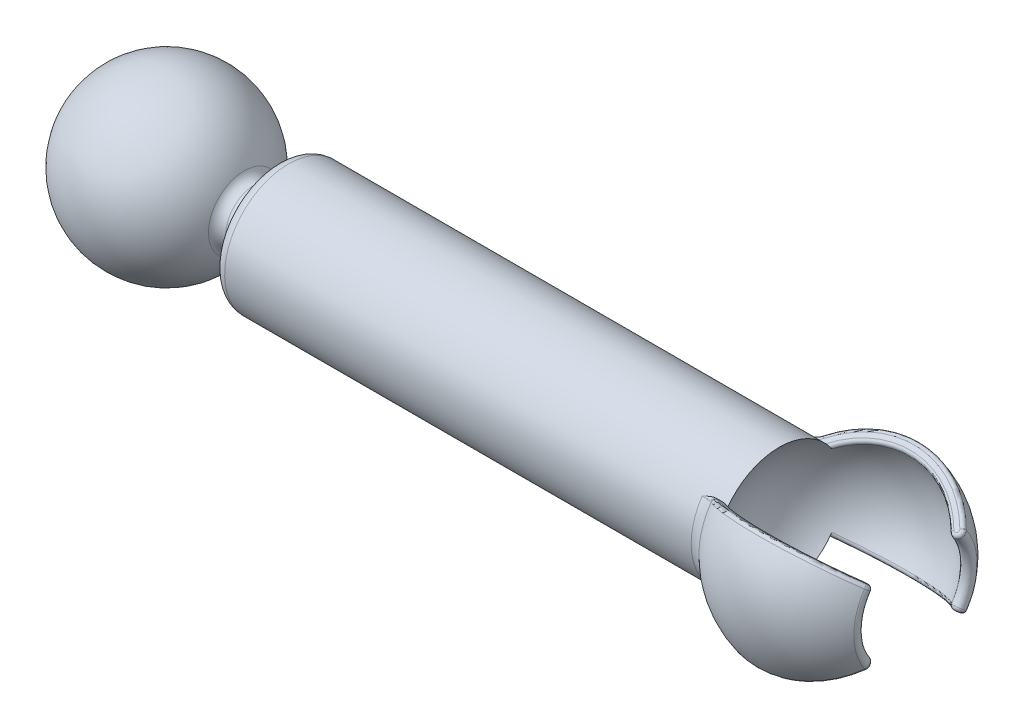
SolidWorks part; units mm, degrees
ref_plane "Front Plane" through (0, 0, 0) normal (0, 0, 1) x (1, 0, 0)
ref_plane "Top Plane" through (0, 0, 0) normal (0, 1, 0) x (1, 0, 0)
ref_plane "Right Plane" through (0, 0, 0) normal (1, 0, 0) x (0, 0, -1)
sketch "Sketch1" plane through (0, 0, 0) normal (0, 0, 1) x (1, 0, 0)
  line L0 (10.795, 3.175) -> (9.6419, 3.175)
  line L1 (12.065, 4.445) -> (12.065, 5.715)
  line L2 (13.335, 6.985) -> (67.0064, 6.985)
  line L3 (73.4822, 0) -> (-15.6104, 0) construction
  line L4 (-9.3472, 0) -> (63.9572, 0)
  arc A0 (8.4886, 3.9133) -> (-9.3472, 0) centre (0, 0) ccw
  arc A1 (67.0064, 6.985) -> (63.9572, 0) centre (73.4822, 0) ccw
  arc A2 (9.6419, 3.175) -> (8.4886, 3.9133) centre (9.6419, 4.445) cw
  arc A3 (10.795, 3.175) -> (12.065, 4.445) centre (10.795, 4.445) ccw
  arc A4 (13.335, 6.985) -> (12.065, 5.715) centre (13.335, 5.715) ccw
  dimension "D1" = 9.3472
  dimension "D2" = 9.525
  dimension "D7" = 1.27
  dimension "D3" = 63.9572
  dimension "D4" = 3.175
  dimension "D5" = 6.985
  dimension "D6" = 12.065
revolve "Revolve1" add sketch "Sketch1" angle 360 about L3
sketch "Sketch2" plane through (0, 0, 0) normal (0, 1, 0) x (1, 0, 0)
  line L0 (0, 0) -> (75.9783, 0) construction
  line L2 (13.335, -6.985) -> (67.0064, -6.985) construction
  line L3 (65.2517, -6.985) -> (67.0064, -6.985)
  arc A0 (67.0064, -6.985) -> (80.9177, -5.9531) centre (73.4822, 0) ccw
  arc A1 (65.2517, -6.985) -> (81.909, -6.7469) centre (73.4822, 0) ccw
  arc A2 (80.9177, -5.9531) -> (81.909, -6.7469) centre (81.4133, -6.35) cw
  arc A3 (67.0064, 6.985) -> (67.0064, -6.985) centre (73.4822, 0) ccw construction
  dimension "D1" = 10.795
  dimension "D3" = 6.35
revolve "Revolve2" add sketch "Sketch2" angle 75 mid plane about L0
mirror "Mirror1" about plane through (0, 0, 0) normal (0, 0, 1) of "Revolve2"
fillet "Fillet2" radius 2.032 2 edges at (65.2517, 0, 6.985) (65.2517, 0, -6.985)
fillet "Fillet3" radius 0.381 16 edges at (81.8102, 3.5639, 4.6445) (65.1425, -4.3477, -5.6661) (74.0456, -6.5626, -8.5526) (81.8102, -3.5639, -4.6445) (74.1868, -5.7826, -7.536) (81.8102, -3.5639, 4.6445) (74.1868, -5.7826, 7.536) (65.1425, -4.3477, 5.6661) (74.0456, -6.5626, 8.5526) (65.1425, 4.3477, 5.6661) (65.1425, 4.3477, -5.6661) (81.8102, 3.5639, -4.6445) (74.0456, 6.5626, -8.5526) (74.1868, 5.7826, -7.536) (74.1868, 5.7826, 7.536) (74.0456, 6.5626, 8.5526)
